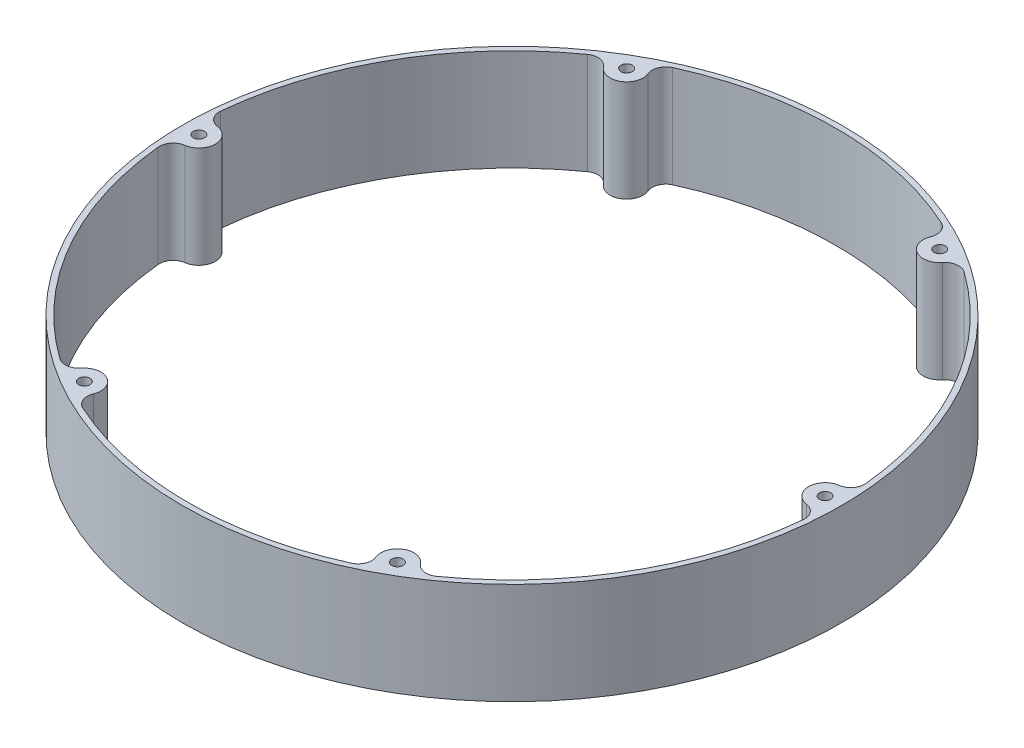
SolidWorks part; units mm, degrees
ref_plane "前视基准面" through (0, 0, 0) normal (0, 0, 1) x (1, 0, 0)
ref_plane "上视基准面" through (0, 0, 0) normal (0, 1, 0) x (1, 0, 0)
ref_plane "右视基准面" through (0, 0, 0) normal (1, 0, 0) x (0, 0, -1)
sketch "草图1" plane through (0, 0, 0) normal (0, 1, 0) x (1, 0, 0)
  circle A0 centre (0, 0) radius 60
  circle A1 centre (0, 0) radius 59
  dimension "D1" = 120
  dimension "D2" = 1
extrude "凸台-拉伸1" add sketch "草图1" along normal blind 18.5
sketch "草图2" plane through (0, 18.5, 0) normal (0, 1, 0) x (1, 0, 0)
  line L0 (0, 0) -> (-59, 0) construction
  line L1 (0, 0) -> (-29.5, 51.0955) construction
  line L2 (0, 0) -> (0, 67.0901) construction
  circle A0 centre (0, 0) radius 59 construction
  circle A1 centre (0, 0) radius 57 construction
  circle A2 centre (0, 0) radius 60 construction
  circle A3 centre (-57, 0) radius 3
  circle A4 centre (-28.5, 49.3634) radius 3
  circle A5 centre (28.5, 49.3634) radius 3
  circle A6 centre (57, 0) radius 3
  circle A7 centre (28.5, -49.3634) radius 3
  circle A8 centre (-28.5, -49.3634) radius 3
  point P25 (0, 0)
  dimension "D2" = 3
  dimension "D1" = 30
  dimension "D3" = 6
extrude "凸台-拉伸2" add sketch "草图2" against normal up to surface (18.5 mm away)
fillet "圆角1" radius 2.5 12 edges at (-58.9561, 9.25, -2.2745) (-58.9561, 9.25, 2.2745) (-27.5083, 9.25, -52.1948) (-31.4479, 9.25, -49.9202) (31.4479, 9.25, -49.9202) (27.5083, 9.25, -52.1948) (58.9561, 9.25, 2.2745) (58.9561, 9.25, -2.2745) (27.5083, 9.25, 52.1948) (31.4479, 9.25, 49.9202) (-31.4479, 9.25, 49.9202) (-27.5083, 9.25, 52.1948)
sketch "草图3" plane through (0, 0, 0) normal (0, -1, 0) x (1, 0, 0)
  circle A0 centre (-28.5, 49.3634) radius 1
  circle A1 centre (28.5, 49.3634) radius 5.6002
  circle A2 centre (-57, 0) radius 4.5847
  circle A3 centre (57, 0) radius 5.2654
  circle A4 centre (-28.5, -49.3634) radius 4.9795
  circle A5 centre (28.5, -49.3634) radius 5.6625
  dimension "D1" = 2
hole_wizard "M2.5 螺纹孔1" positions "3D草图1" profile "草图4" tap size "M2.5" standard "GB"
sketch3d "3D草图1"
  point P0 (28.5, 0, 49.3634)
  point P3 (-28.5, 0, 49.3634)
  point P6 (-57, 0, 0)
  point P9 (-28.5, 0, -49.3634)
  point P12 (28.5, 0, -49.3634)
  point P15 (57, 0, 0)
sketch "草图4" plane through (28.5, 0, 49.3634) normal (1, 0, 0) x (0, 0, -1)
  line L0 (0, 0) -> (0, 18.5)
  line L1 (0, 18.5) -> (1.025, 18.5)
  line L2 (1.025, 18.5) -> (1.025, 0)
  line L5 (1.025, 0) -> (0, 0)
  line L11 (0, -6.35) -> (0, 107.95) construction
  dimension "通孔螺纹孔钻头直径" = 2.05
  dimension "通孔螺纹孔钻头深度" = 18.5
